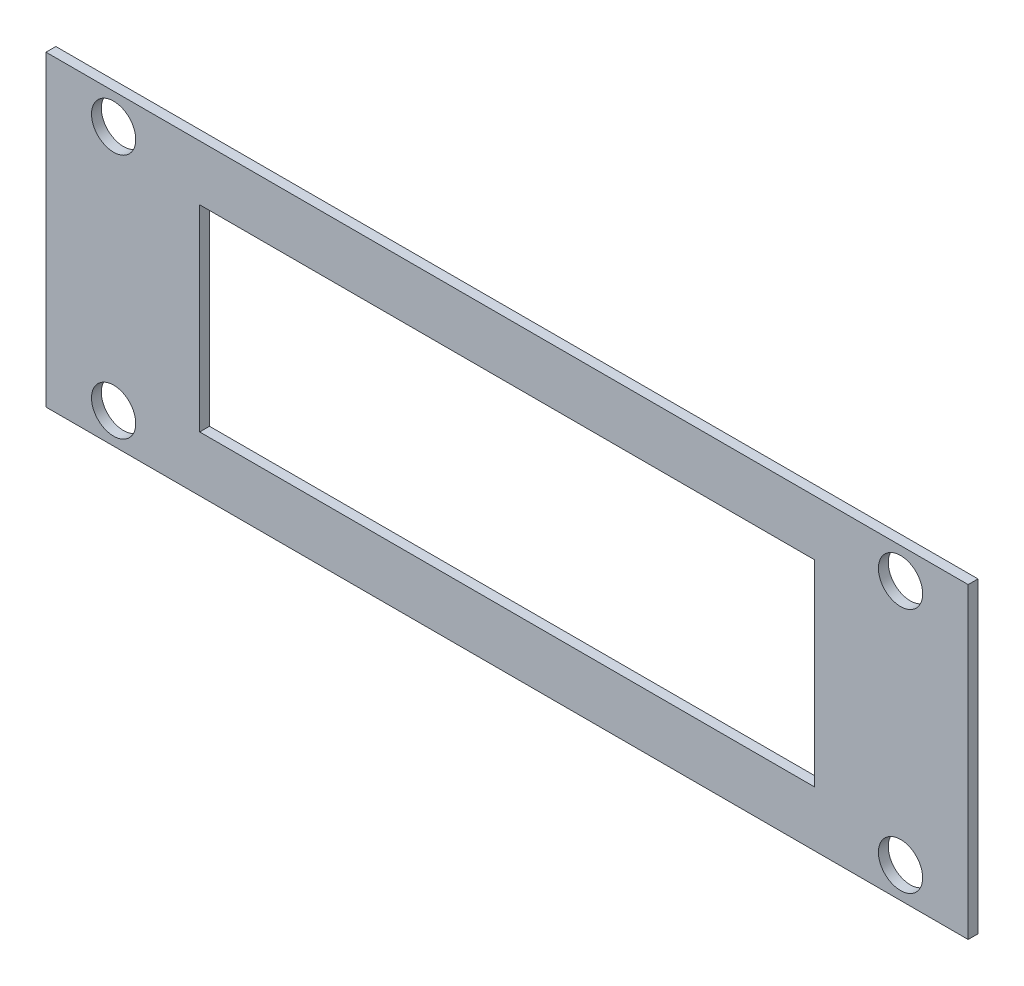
SolidWorks part; units mm, degrees
ref_plane "Front Plane" through (0, 0, 0) normal (0, 0, 1) x (1, 0, 0)
ref_plane "Top Plane" through (0, 0, 0) normal (0, 1, 0) x (1, 0, 0)
ref_plane "Right Plane" through (0, 0, 0) normal (1, 0, 0) x (0, 0, -1)
sketch "Sketch1" plane through (0, 0, 0) normal (0, 0, 1) x (1, 0, 0)
  line L0 (-75.3864, 0) -> (64.1619, 0) construction
  line L1 (0, 38.0724) -> (0, -36.2522) construction
  line L2 (-47.625, 15.875) -> (-47.625, -15.875)
  line L3 (-47.625, 15.875) -> (47.625, 15.875)
  line L4 (-47.625, -15.875) -> (47.625, -15.875)
  line L5 (-47.625, -15.875) -> (-47.625, 15.875)
  line L6 (47.625, 15.875) -> (47.625, -15.875)
  line L7 (-31.75, 10.16) -> (-31.75, -10.16)
  line L8 (-31.75, 10.16) -> (31.75, 10.16)
  line L9 (-31.75, -10.16) -> (31.75, -10.16)
  line L10 (31.75, 10.16) -> (31.75, -10.16)
  circle A0 centre (-40.64, 12.7) radius 2.286
  circle A1 centre (40.64, 12.7) radius 2.286
  circle A2 centre (-40.64, -12.7) radius 2.286
  circle A3 centre (40.64, -12.7) radius 2.286
  dimension "D3" = 4.572
  dimension "D4" = 25.4
  dimension "D1" = 95.25
  dimension "D2" = 31.75
  dimension "D5" = 40.64
  dimension "D6" = 63.5
  dimension "D7" = 20.32
extrude "Extrude1" add sketch "Sketch1" along normal blind 1.016 contours L6 L3 L2 L4 A3 A1 A0 L8 L10 L9 L7 A2
